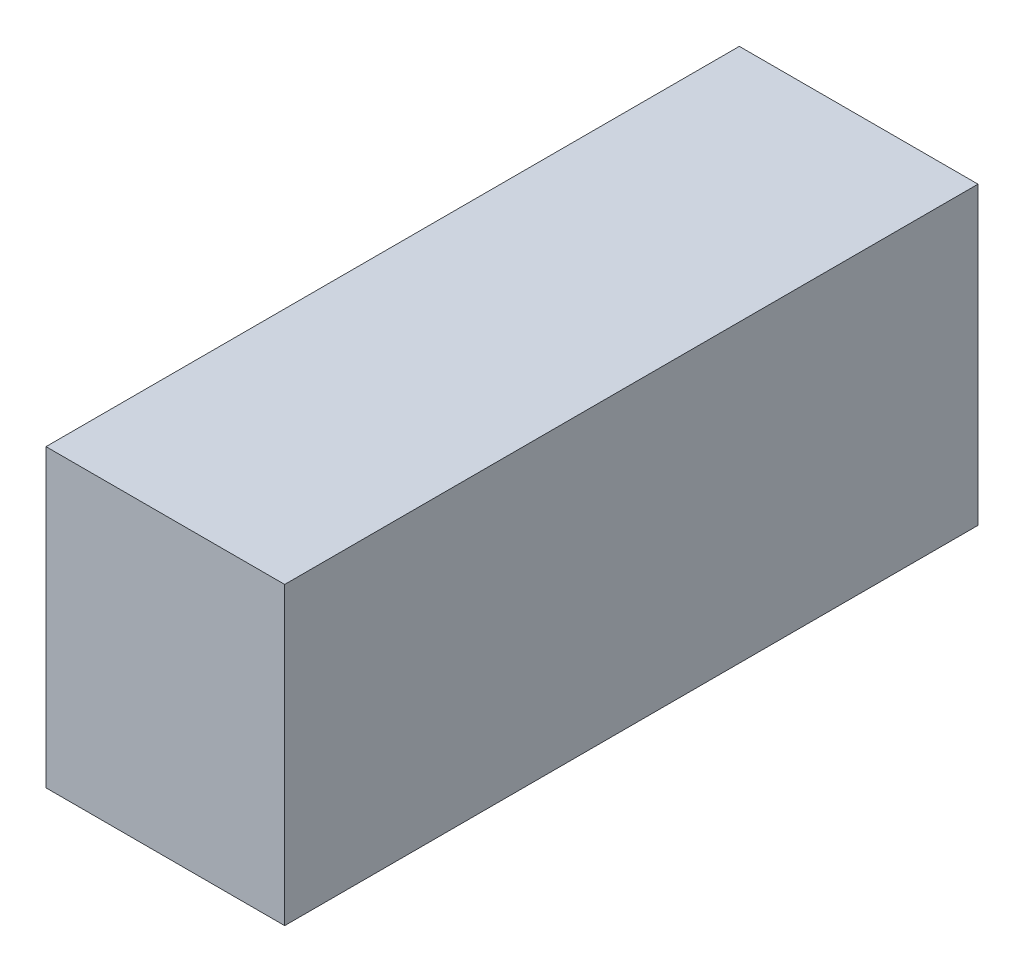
SolidWorks part; units mm, degrees
ref_plane "Front Plane" through (0, 0, 0) normal (0, 0, 1) x (1, 0, 0)
ref_plane "Top Plane" through (0, 0, 0) normal (0, 1, 0) x (1, 0, 0)
ref_plane "Right Plane" through (0, 0, 0) normal (1, 0, 0) x (0, 0, -1)
sketch "Sketch1" plane through (0, 0, 0) normal (0, 0, 1) x (1, 0, 0)
  line L0 (-82.075, 62.1486) -> (-82.075, 57.1486)
  line L1 (-82.075, 57.1486) -> (17.925, 57.1486)
  line L2 (17.925, 57.1486) -> (17.925, -62.8514)
  line L3 (17.925, -62.8514) -> (-82.075, -62.8514)
  line L4 (-82.075, -62.8514) -> (-82.075, -67.8514)
  line L5 (-82.075, -67.8514) -> (22.925, -67.8514)
  line L6 (22.925, -67.8514) -> (22.925, 62.1486)
  line L7 (22.925, 62.1486) -> (-82.075, 62.1486)
  dimension "D1" = 105
  dimension "D2" = 100
  dimension "D3" = 130
  dimension "D4" = 5
  dimension "D5" = 5
extrude "Boss-Extrude1" add sketch "Sketch1" along normal blind 300
sketch "Sketch2" plane through (0, 0, 300) normal (0, 0, 1) x (1, 0, 0)
  line L1 (-82.075, 62.1486) -> (22.925, 62.1486)
  line L2 (-82.075, 62.1486) -> (-82.075, -67.8514)
  line L3 (-82.075, -67.8514) -> (22.925, -67.8514)
  line L4 (22.925, 62.1486) -> (22.925, -67.8514)
extrude "Boss-Extrude2" add sketch "Sketch2" along normal blind 5
